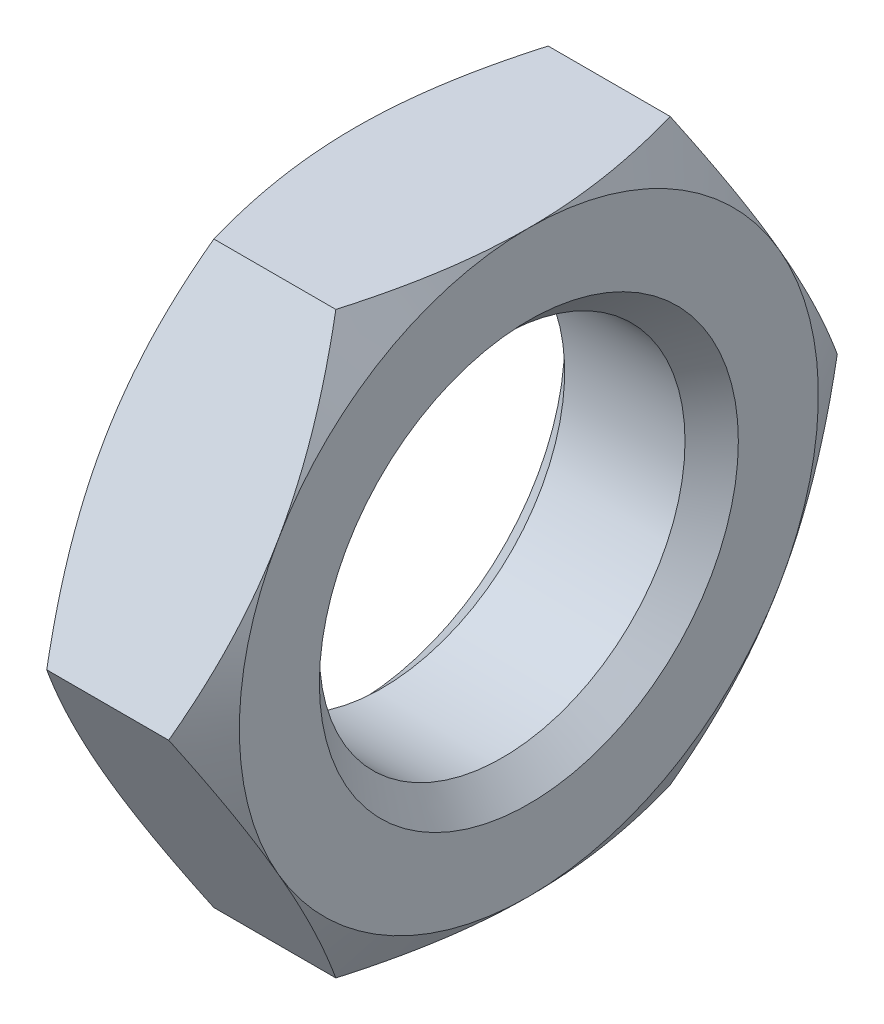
SolidWorks part; units mm, degrees
ref_plane "Front Plane" through (0, 0, 0) normal (0, 0, 1) x (1, 0, 0)
ref_plane "Top Plane" through (0, 0, 0) normal (0, 1, 0) x (1, 0, 0)
ref_plane "Right Plane" through (0, 0, 0) normal (1, 0, 0) x (0, 0, -1)
sketch "Sketch1" plane through (0, 0, 0) normal (1, 0, 0) x (0, 0, -1)
  line L1 (5.4848, 9.5) -> (-5.4848, 9.5)
  line L2 (-5.4848, 9.5) -> (-10.9697, 0)
  line L3 (-10.9697, 0) -> (-5.4848, -9.5)
  line L4 (-5.4848, -9.5) -> (5.4848, -9.5)
  line L5 (5.4848, -9.5) -> (10.9697, 0)
  line L6 (10.9697, 0) -> (5.4848, 9.5)
  circle A0 centre (0, 0) radius 9.5 construction
  circle A1 centre (0, 0) radius 6
extrude "Extrude1" add sketch "Sketch1" along normal blind 5.7
sketch "Sketch2" plane through (0, 0, 0) normal (0, 0, 1) x (1, 0, 0)
  line L0 (5.7, 9.5) -> (5.7, 38)
  line L1 (5.7, 38) -> (0, 38)
  line L2 (0, 38) -> (0, 9.5)
  line L3 (0, 9.5) -> (2.85, 14.4363)
  line L4 (2.85, 14.4363) -> (5.7, 9.5)
revolve "Cut-Revolve1" cut sketch "Sketch2" angle 360 about axis through (5.7, 0, 0) along (-1, 0, 0)
chamfer "Chamfer1" distance 0.875 angle 45 2 edges at (0, 0, -6) (5.7, 0, -6)
equation "\"D2@Sketch2\"=\"D1@Sketch1\"*2"
